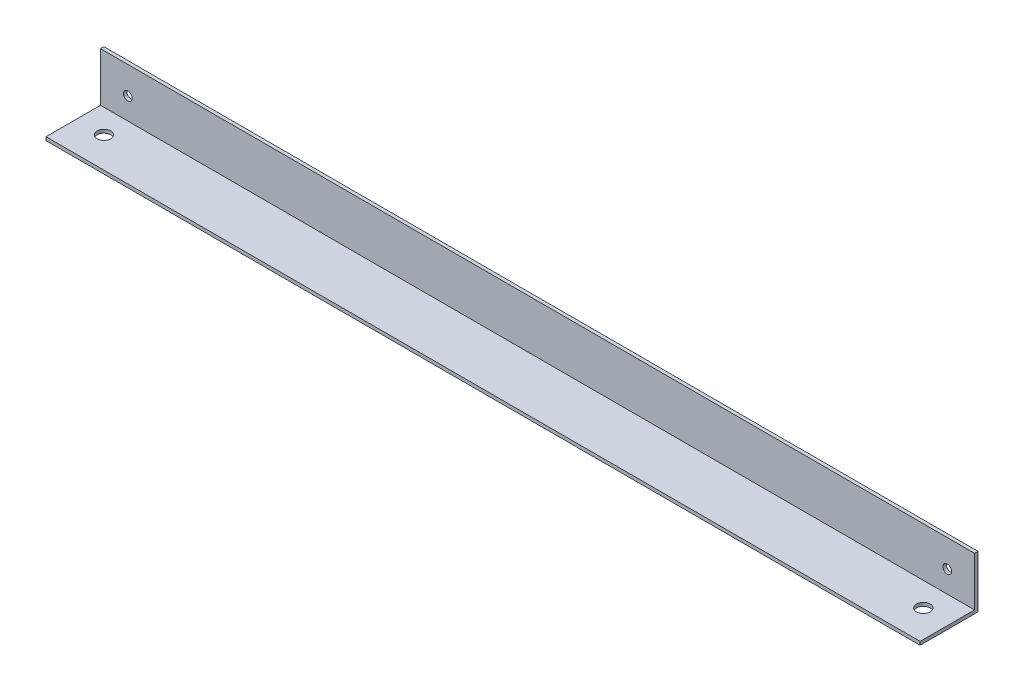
SolidWorks part; units mm, degrees
ref_plane "Front" through (0, 0, 0) normal (0, 0, 1) x (1, 0, 0)
ref_plane "Top" through (0, 0, 0) normal (0, 1, 0) x (1, 0, 0)
ref_plane "Right" through (0, 0, 0) normal (1, 0, 0) x (0, 0, -1)
sketch "Sketch1" plane through (0, 0, 0) normal (0, 0, 1) x (1, 0, 0)
  line L1 (-209.8261, 67.8385) -> (196.5739, 67.8385)
  line L2 (-209.8261, 67.8385) -> (-209.8261, 43.4545)
  line L3 (-209.8261, 43.4545) -> (196.5739, 43.4545)
  line L4 (196.5739, 67.8385) -> (196.5739, 43.4545)
  dimension "D1" = 406.4
  dimension "D2" = 24.384
extrude "Boss-Extrude1" add sketch "Sketch1" along normal blind 26.924
sketch "Sketch2" plane through (0, 67.8385, 0) normal (0, 1, 0) x (1, 0, 0)
  line L0 (-209.8261, -26.924) -> (-209.8261, 0) construction
  line L1 (-209.8261, -1.5875) -> (196.5739, -1.5875)
  line L2 (-209.8261, -1.5875) -> (-209.8261, -26.924)
  line L3 (-209.8261, -26.924) -> (196.5739, -26.924)
  line L4 (196.5739, -1.5875) -> (196.5739, -26.924)
  line L5 (196.5739, 0) -> (-209.8261, 0) construction
  dimension "D1" = 1.5875
extrude "Cut-Extrude1" cut sketch "Sketch2" against normal blind 12.7
sketch "Sketch3" plane through (0, 0, 26.924) normal (0, 0, 1) x (1, 0, 0)
  line L0 (196.5739, 43.4545) -> (196.5739, 55.1385) construction
  line L1 (-209.8261, 55.1385) -> (196.5739, 55.1385)
  line L2 (-209.8261, 55.1385) -> (-209.8261, 45.042)
  line L3 (-209.8261, 45.042) -> (196.5739, 45.042)
  line L4 (196.5739, 55.1385) -> (196.5739, 45.042)
  line L5 (-209.8261, 43.4545) -> (196.5739, 43.4545) construction
  dimension "D1" = 1.5875
extrude "Cut-Extrude3" cut sketch "Sketch3" against normal up to surface (25.3365 mm away)
sketch "Sketch4" plane through (0, 43.4545, 0) normal (0, -1, 0) x (1, 0, 0)
  line L0 (-209.8261, 0) -> (196.5739, 0) construction
  line L1 (-209.8261, 26.924) -> (-209.8261, 0) construction
  line L2 (-6.6261, 26.924) -> (-6.6261, -64.6227) construction
  line L3 (-209.8261, 26.924) -> (196.5739, 26.924) construction
  circle A0 centre (-197.1261, 12.7) radius 3.175
  circle A1 centre (183.8739, 12.7) radius 3.175
  dimension "D1" = 6.35
  dimension "D2" = 12.7
  dimension "D3" = 12.7
sketch "Sketch5" plane through (0, 0, 0) normal (0, 0, -1) x (-1, 0, 0)
  line L0 (6.6261, 77.4225) -> (6.6261, -19.794) construction
  line L1 (-196.5739, 67.8385) -> (209.8261, 67.8385) construction
  line L2 (-196.5739, 43.4545) -> (-196.5739, 67.8385) construction
  circle A0 centre (-183.8739, 55.1385) radius 2.032
  circle A1 centre (197.1261, 55.1385) radius 2.032
  dimension "D3" = 4.064
  dimension "D1" = 12.7
  dimension "D2" = 12.7
extrude "Cut-Extrude4" cut sketch "Sketch4" against normal blind 2.54
extrude "Cut-Extrude5" cut sketch "Sketch5" against normal blind 2.54
equation "\".5n\"=1"
